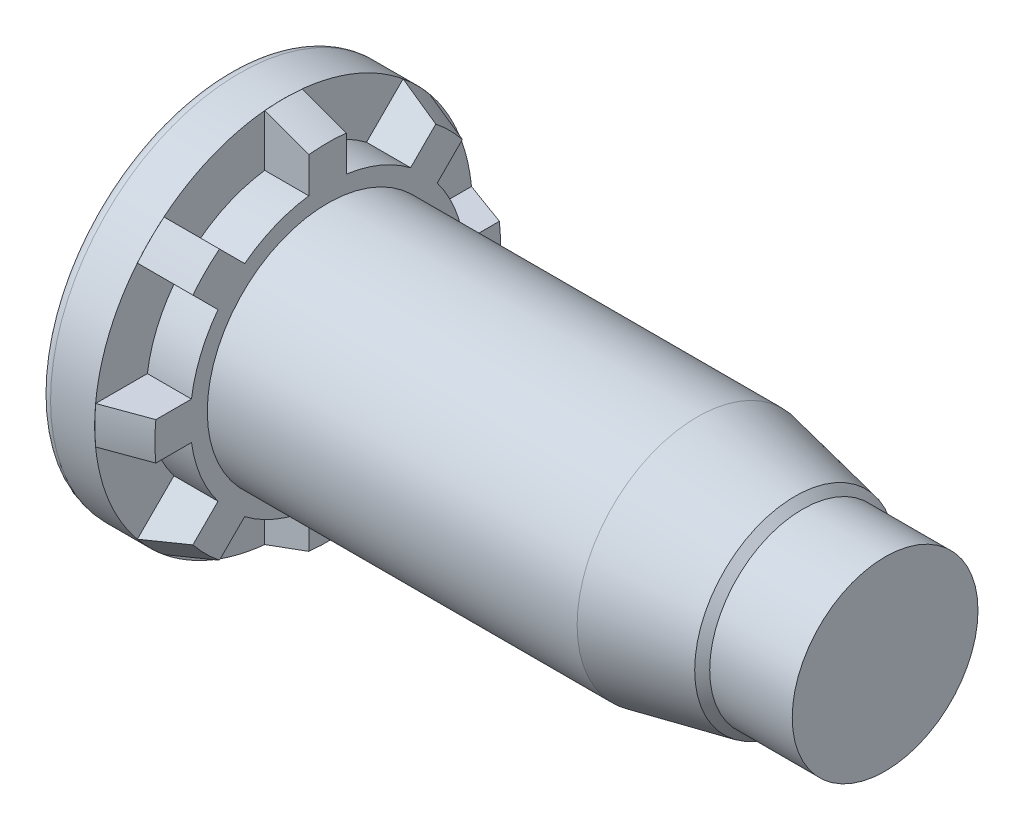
SolidWorks part; units mm, degrees
ref_plane "Plane1" through (0, 0, 0) normal (0, 0, 1) x (1, 0, 0)
ref_plane "Plane2" through (0, 0, 0) normal (0, 1, 0) x (1, 0, 0)
ref_plane "Plane3" through (0, 0, 0) normal (1, 0, 0) x (0, 0, -1)
sketch "BodySke" plane through (0, 0, 0) normal (0, 0, 1) x (1, 0, 0)
  line L0 (-2.29, 7.392) -> (-2.29, 0)
  line L1 (1.832, 7.1816) -> (1.832, 5)
  line L2 (0.0025, 7.8475) -> (1.832, 7.1816)
  line L3 (1.832, 5) -> (17.2, 5)
  line L4 (17.2, 5) -> (21.258, 4.172)
  line L5 (25, 0) -> (-2.29, 0)
  line L6 (0, 0) -> (50.554, 0) construction
  line L7 (21.57, 3.86) -> (25, 3.86)
  line L8 (21.57, 3.86) -> (21.258, 4.172)
  line L9 (-1.832, 7.85) -> (0, 7.85)
  line L10 (0.0025, 7.8475) -> (0, 7.8475)
  line L11 (1.5, 19.05) -> (1.5, -3.175) construction
  line L12 (0, 7.8475) -> (0, 7.85)
  line L13 (25, 3.86) -> (25, 0)
  arc A0 (-2.29, 7.392) -> (-1.832, 7.85) centre (-1.832, 7.392) cw
  dimension "D2" = 0.0025
  dimension "Fillet_rad" = 0.458
  dimension "D1" = 20
  dimension "Diameter" = 10
  dimension "D3" = 0.0025
  dimension "D4" = 45
  dimension "Length" = 25
  dimension "Minor_dia" = 8.344
  dimension "Advance" = 1.5
  dimension "H_dia" = 15.7
  dimension "T_dim" = 2.29
  dimension "Clinch_ht" = 1.832
  dimension "Dog_len" = 3.43
  dimension "Dog_dia" = 7.72
  dimension "Thread_trans" = 4.37
revolve "BaseBody" add sketch "BodySke" angle 360 about L6
sketch "ThdSchSke" plane through (0, 0, 0) normal (0, 0, 1) x (1, 0, 0)
  line L0 (4.1, -4.172) -> (3.5202, -5)
  line L1 (4.1, -4.172) -> (4.6798, -5)
  line L2 (4.6798, -5) -> (4.6798, -6.25)
  line L3 (-3.175, 0) -> (5.1513, 0) construction
  line L4 (0, -7.85) -> (0, 7.85) construction
  line L5 (4.6798, -6.25) -> (3.5202, -6.25)
  line L6 (3.5202, -6.25) -> (3.5202, -5)
  line L7 (22.1518, 6.5809) -> (22.1518, 1.1961) construction
  dimension "Thread_minor" = 8.344
  dimension "Diameter" = 10
  dimension "Start" = 4.1
  dimension "SideAngle" = 55
  dimension "VeeAngle" = 70
  dimension "Overcut" = 12.5
  dimension "Thread_length" = 18.0518
revolve "ThreadSchematic" [suppressed] cut sketch "ThdSchSke" angle 360 about L3
pattern_linear "ThdSchPat" [suppressed]
sketch "RibCutSke" plane through (1.832, 1.7944, -0.091) normal (1, 0, 0) x (0, 0, -1)
  line L0 (0.6912, 3.8643) -> (0.6912, 6.0165)
  line L1 (3.3573, 2.76) -> (4.8791, 4.2818)
  line L2 (0.6912, 3.144) -> (0.6912, 2.4006) construction
  line L3 (-0.091, -1.7944) -> (-0.091, 5.0239) construction
  line L4 (-0.091, -1.7944) -> (0.6912, 3.144) construction
  line L5 (-0.091, -1.7944) -> (2.848, 2.2507) construction
  line L6 (2.848, 2.2507) -> (2.3273, 1.73) construction
  arc A1 (3.3573, 2.76) -> (0.6912, 3.8643) centre (-0.091, -1.7944) ccw
  arc A2 (4.8791, 4.2818) -> (0.6912, 6.0165) centre (-0.091, -1.7944) ccw
  circle A3 centre (-0.091, -1.7944) radius 7.1816 construction
  circle A4 centre (-0.091, -1.7944) radius 5 construction
  dimension "Inner_dia" = 11.425
  dimension "Outer_dia" = 15.7
  dimension "Rib_root_dia" = 10
  dimension "Rib_root_half_angle" = 9
  dimension "Rib_root_gap_angle" = 27
  dimension "Angle" = 45
extrude "RibCut" cut sketch "RibCutSke" against normal blind 1.832
pattern_circular "RibCutsPat" count 8 every 45 about axis through (0, 0, 0) along (1, 0, 0) of "RibCut"
equation "' \"Length@BodySke\" = 25"
equation "' \"H_dia@BodySke\" = 15.7"
equation "' \"Start@ThdSchSke\" = 4.1"
equation "' \"T_dim@BodySke\" = 2.29"
equation "' \"Dog_dia@BodySke\" = 7.72"
equation "' \"Dog_len@BodySke\" = 3.43"
equation "' \"Thread_trans@BodySke\" = 4.37"
equation "' \"Diameter@BodySke\" = 10"
equation "' \"Minor_dia@BodySke\" =  8.344"
equation "' \"Advance@BodySke\" = 1.5"
equation "\"Fillet_rad@BodySke\" =  \"T_dim@BodySke\" * 0.2"
equation "\"Clinch_ht@BodySke\" = \"T_dim@BodySke\" * 0.8"
equation "\"Num_ribs@RibCutsPat\" = 8"
equation "\"Angle@RibCutSke\" =\"Angle@RibCutsPat\""
equation "\"Rib_root_half_angle@RibCutSke\" = \"Angle@RibCutSke\" / 5"
equation "\"Rib_root_gap_angle@RibCutSke\" = \"Angle@RibCutSke\" - (2 * \"Rib_root_half_angle@RibCutSke\" )"
equation "\"Rib_root_dia@RibCutSke\" = \"Diameter@BodySke\""
equation "\"Inner_dia@RibCutSke\" = \"Diameter@BodySke\" + ( \"H_dia@BodySke\" - \"Diameter@BodySke\" ) / 4"
equation "\"Outer_dia@RibCutSke\" = \"H_dia@BodySke\""
equation "\"Depth@RibCut\" = \"Clinch_ht@BodySke\""
equation "\"Thread_length@ThreadCosmetic\" = \"Length@BodySke\" - \"Start@ThdSchSke\"  - \"Dog_len@BodySke\"  - ( \"Minor_dia@BodySke\" - \"Dog_dia@BodySke\" ) / 2"
equation "\"Thread_minor@ThreadCosmetic\" = \"Minor_dia@BodySke\""
equation "\"Thread_minor@ThdSchSke\" = \"Minor_dia@BodySke\""
equation "\"Diameter@ThdSchSke\" = \"Diameter@BodySke\""
equation "\"Overcut@ThdSchSke\" = \"Diameter@BodySke\" * 1.25"
equation "\"Num_threads@ThdSchPat\" = int( \"Thread_length@ThreadCosmetic\" / \"Advance@BodySke\" + 0.999 )  + 1"
equation "\"Advance@ThdSchPat\" = \"Thread_length@ThreadCosmetic\" /  (\"Num_threads@ThdSchPat\" - 1) 'relax it"
equation "\"Num_threads@ThdSchPat\" = \"Num_threads@ThdSchPat\" - sgn( \"Num_threads@ThdSchPat\" - 1) '---chamfered tips only---"
